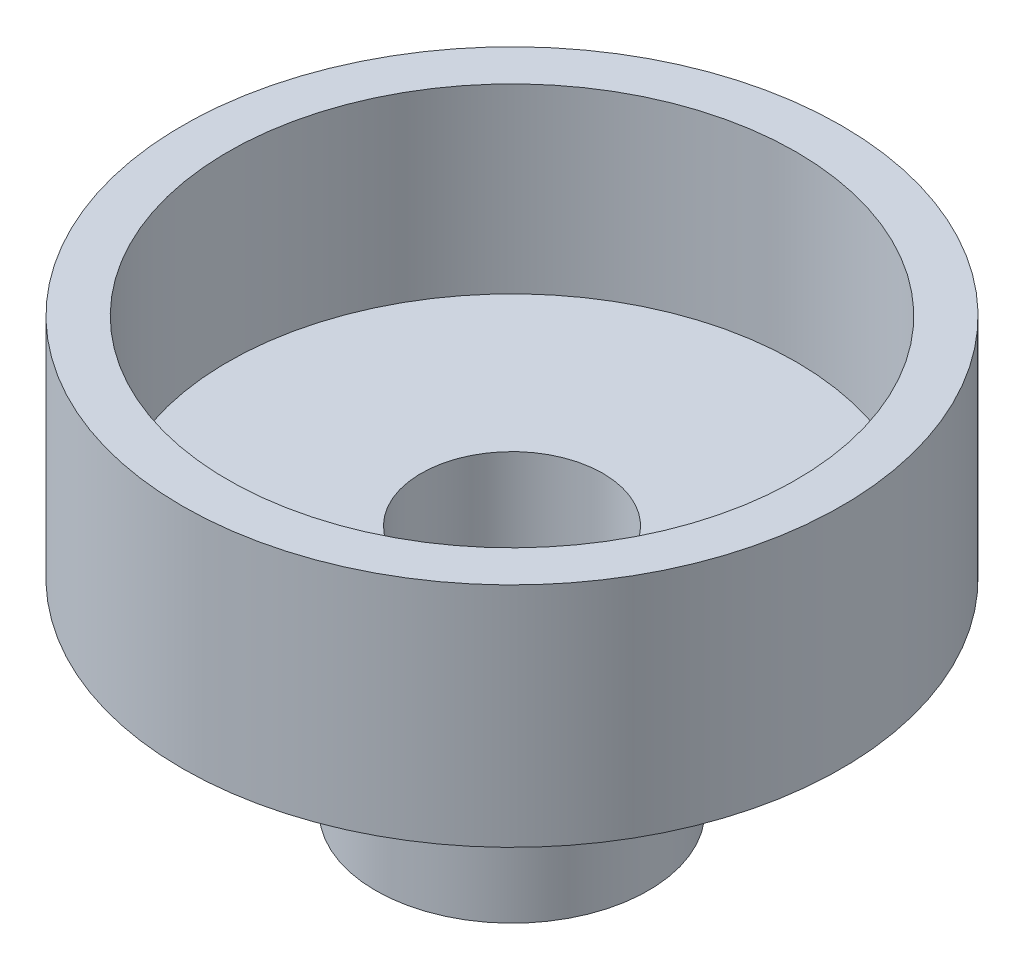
SolidWorks part; units mm, degrees
ref_plane "Plan de face" through (0, 0, 0) normal (0, 0, 1) x (1, 0, 0)
ref_plane "Plan de dessus" through (0, 0, 0) normal (0, 1, 0) x (1, 0, 0)
ref_plane "Plan de droite" through (0, 0, 0) normal (1, 0, 0) x (0, 0, -1)
ref_axis "Axe1" through (0, -55, 0) along (0, 1, 0)
sketch "Esquisse2" plane through (0, 0, 0) normal (0, 0, 1) x (1, 0, 0)
  line L0 (62.5, 75.1827) -> (62.5, 35.1827)
  line L1 (62.5, 35.1827) -> (20, 35.1827)
  line L2 (20, 35.1827) -> (20, 12.6827)
  line L3 (72.5, 75.1827) -> (72.5, 25.1827)
  line L4 (72.5, 25.1827) -> (30, 25.1827)
  line L5 (30, 25.1827) -> (30, -19.3173)
  line L6 (0, -55) -> (0, 55) construction
  line L7 (62.5, 75.1827) -> (72.5, 75.1827)
  line L8 (20, -19.3173) -> (30, -19.3173)
  line L9 (20, 35.1827) -> (20, -19.3173) construction
  line L10 (20, 12.6827) -> (21.5, 12.6827)
  line L11 (21.5, 12.6827) -> (21.5, 11.1827)
  line L12 (21.5, 11.1827) -> (20, 11.1827)
  line L13 (20, 11.1827) -> (20, -19.3173)
  dimension "D2" = 62.5
  dimension "D3" = 1.5
  dimension "D4" = 44.5
  dimension "D5" = 40
  dimension "D6" = 22.5
  dimension "D7" = 1.5
  dimension "D8" = 20
  dimension "D1" = 10
revolve "Révolution1" add sketch "Esquisse2" angle 360 about axis through (0, -55, 0) along (0, 1, 0)
